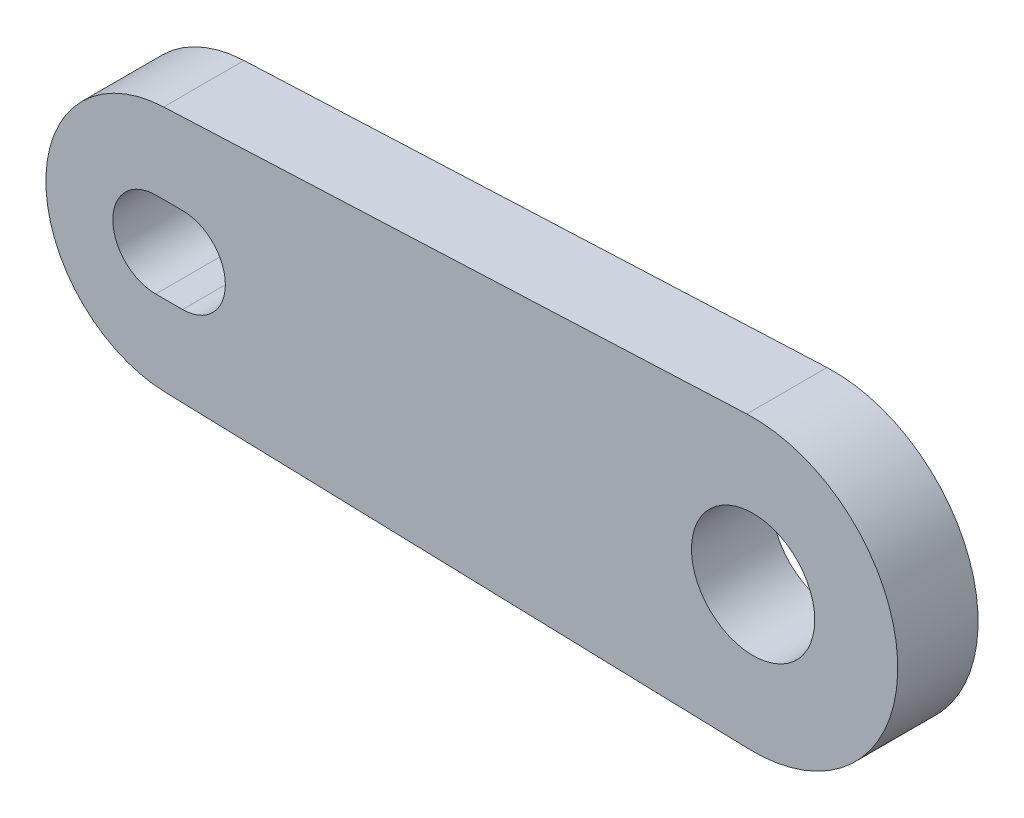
SolidWorks part; units mm, degrees
ref_plane "Front Plane" through (0, 0, 0) normal (0, 0, 1) x (1, 0, 0)
ref_plane "Top Plane" through (0, 0, 0) normal (0, 1, 0) x (1, 0, 0)
ref_plane "Right Plane" through (0, 0, 0) normal (1, 0, 0) x (0, 0, -1)
sketch "Sketch1" plane through (0, 0, -7.4817) normal (0, 0, 1) x (1, 0, 0)
  line L0 (-0.1378, 0.1535) -> (-21.9023, -0.8044)
  line L1 (17.6263, 61.679) -> (5.6263, 61.679) construction
  line L2 (-0.0592, -10.639) -> (-21.8353, -9.998)
  line L3 (-21.7, -5.4) -> (-21.2, -5.4) construction
  line L4 (-21.2, -3.8) -> (-22.2, -3.8)
  line L5 (-21.2, -7) -> (-22.2, -7)
  line L6 (-21.7, -3.8) -> (-21.7, -7) construction
  arc A0 (-21.2, -7) -> (-21.2, -3.8) centre (-21.2, -5.4) ccw
  circle A1 centre (0.0997, -5.2413) radius 5.4 construction
  circle A2 centre (0.0997, -5.2413) radius 2.4 construction
  arc A3 (-22.2, -7) -> (-22.2, -3.8) centre (-22.2, -5.4) cw
  arc A4 (-0.0592, -10.639) -> (-0.1378, 0.1535) centre (0.0997, -5.2413) ccw
  arc A5 (-21.9023, -0.8044) -> (-21.8353, -9.998) centre (-21.7, -5.4) ccw
  circle A6 centre (0.0997, -5.2413) radius 2.3
  dimension "D2" = 0.5
  dimension "D3" = 0.1
  dimension "D7" = 4.8
  dimension "D4" = 17.6263
  dimension "D8" = 0.0997
  dimension "D9" = 17.6263
  dimension "D10" = 66.9203
  dimension "D1" = 3
extrude "Boss-Extrude1" add sketch "Sketch1" along normal blind 3 contours A4 L0 A5 L2
